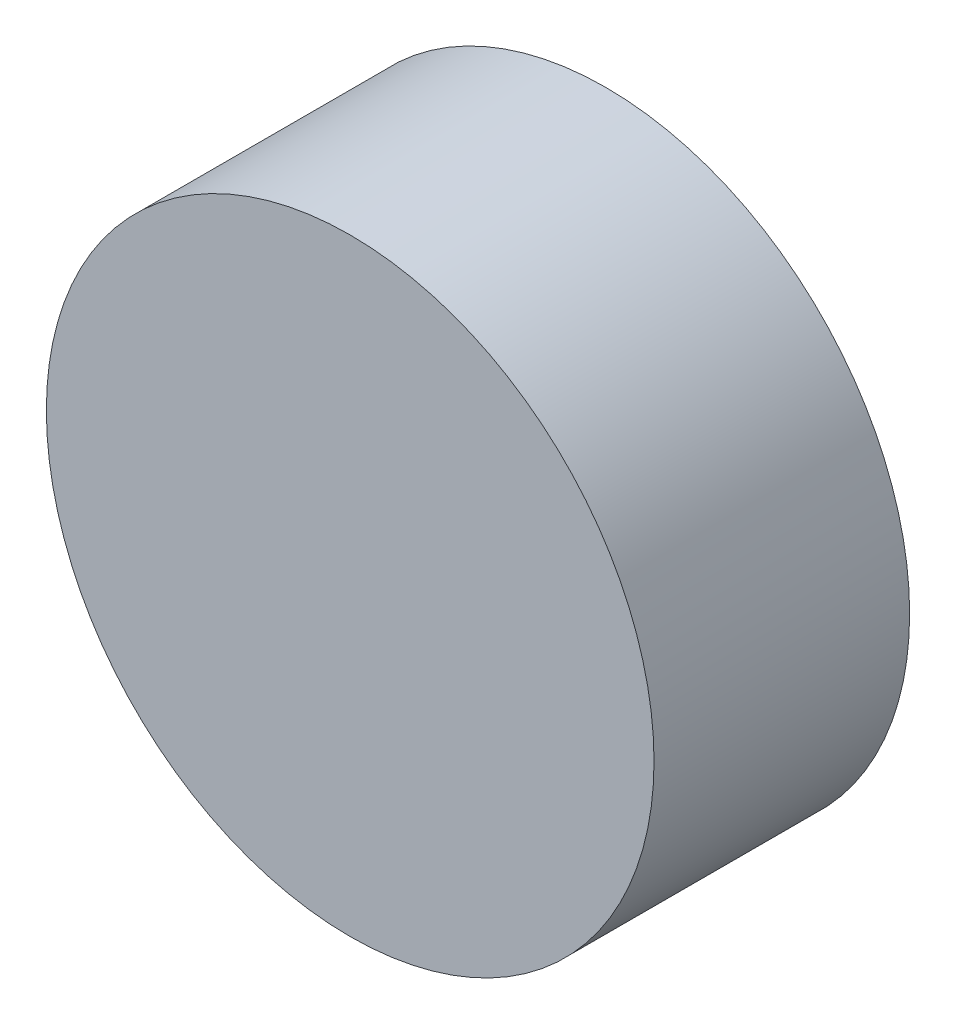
SolidWorks part; units mm, degrees
ref_plane "Front Plane" through (0, 0, 0) normal (0, 0, 1) x (1, 0, 0)
ref_plane "Top Plane" through (0, 0, 0) normal (0, 1, 0) x (1, 0, 0)
ref_plane "Right Plane" through (0, 0, 0) normal (1, 0, 0) x (0, 0, -1)
sketch "Sketch1" plane through (0, 0, 0) normal (0, 0, 1) x (1, 0, 0)
  circle A0 centre (0, 0) radius 32.004
  dimension "D1" = 64.008
extrude "Boss-Extrude1" add sketch "Sketch1" along normal blind 26.924
